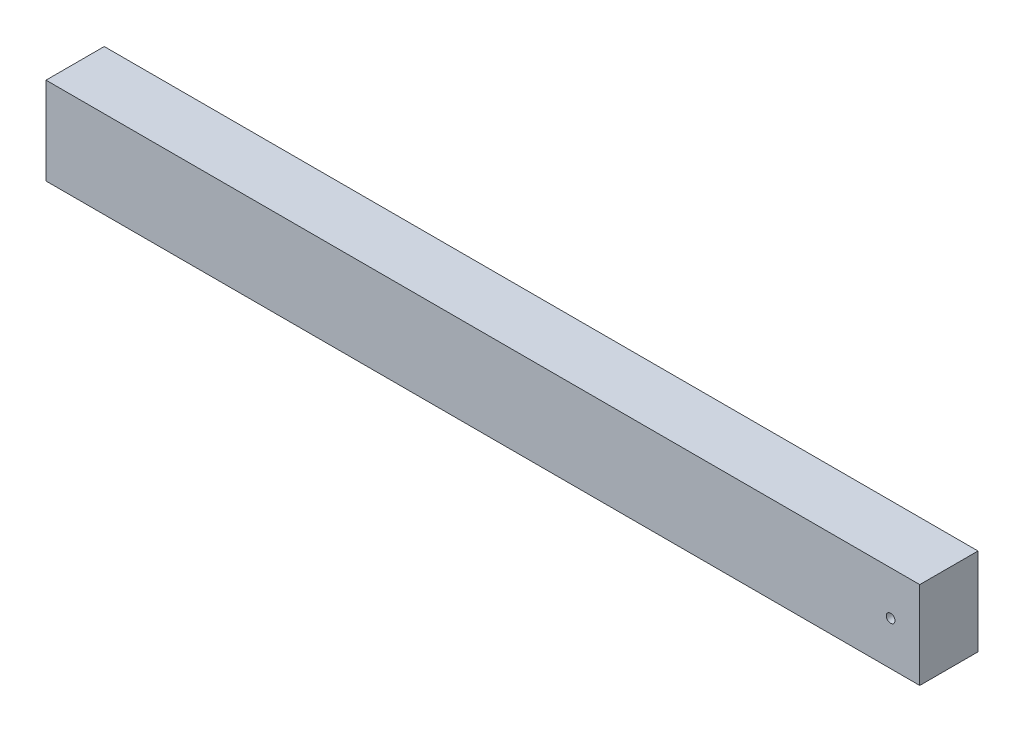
SolidWorks part; units mm, degrees
ref_plane "Plan de face" through (0, 0, 0) normal (0, 0, 1) x (1, 0, 0)
ref_plane "Plan de dessus" through (0, 0, 0) normal (0, 1, 0) x (1, 0, 0)
ref_plane "Plan de droite" through (0, 0, 0) normal (1, 0, 0) x (0, 0, -1)
sketch "Esquisse1" plane through (0, 0, 0) normal (0, 0, 1) x (1, 0, 0)
  line L1 (300, -30) -> (-300, -30)
  line L2 (300, -30) -> (300, 30)
  line L3 (300, 30) -> (-300, 30)
  line L4 (-300, -30) -> (-300, 30)
  line L5 (300, -30) -> (-300, 30) construction
  line L6 (300, 30) -> (-300, -30) construction
  circle A0 centre (280, 0) radius 3
  point P0 (0, 0)
  point P8 (0, 0)
  dimension "D2" = 6
  dimension "D3" = 20
  dimension "D1" = 60
  dimension "D4" = 600
extrude "Boss.-Extru.1" add sketch "Esquisse1" along normal mid plane 40
